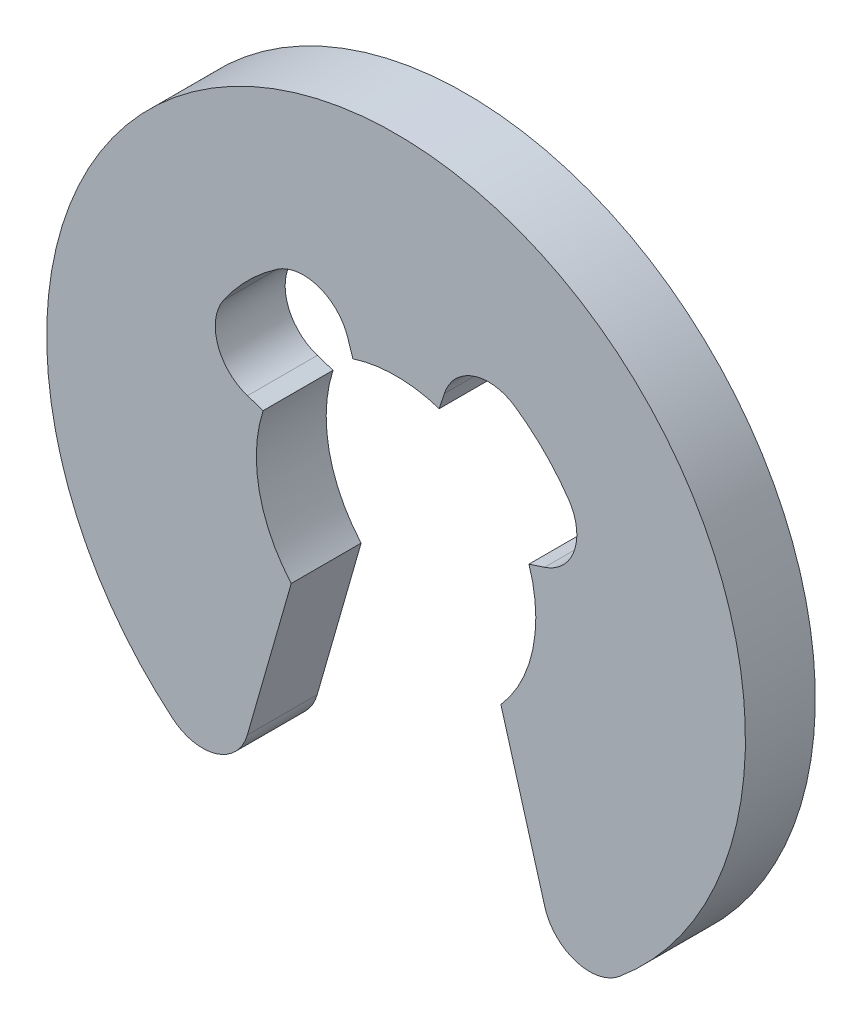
SolidWorks part; units mm, degrees
ref_plane "Front" through (0, 0, 0) normal (0, 0, 1) x (1, 0, 0)
ref_plane "Top" through (0, 0, 0) normal (0, 1, 0) x (1, 0, 0)
ref_plane "Right" through (0, 0, 0) normal (1, 0, 0) x (0, 0, -1)
sketch "Sketch1" plane through (0, 0, 0) normal (0, 0, 1) x (1, 0, 0)
  line L0 (0, 2.1875) -> (0, -1.9262) construction
  line L1 (-1.6904, 0) -> (1.9829, 0) construction
  line L2 (0, 0) -> (0.4635, 1.4266) construction
  line L3 (0, 0) -> (1.4266, 0.4635) construction
  line L4 (0.2073, 0.638) -> (0.1854, 0.5706)
  line L5 (0.5706, 0.1854) -> (0.638, 0.2073)
  line L6 (0.45, -0.3969) -> (0.6387, -1.0549)
  line L7 (-0.5706, 0.1854) -> (-0.638, 0.2073)
  line L8 (-0.2073, 0.638) -> (-0.1854, 0.5706)
  line L9 (-0.45, -0.3969) -> (-0.6387, -1.0549)
  arc A0 (0.9588, -1.1536) -> (-0.9588, -1.1536) centre (0, 0) ccw
  arc A1 (0.45, -0.3969) -> (0.5706, 0.1854) centre (0, 0) ccw
  arc A2 (0.7408, 0.5111) -> (0.5111, 0.7408) centre (0, 0) ccw
  arc A3 (0.7408, 0.5111) -> (0.638, 0.2073) centre (0.5762, 0.3975) cw
  arc A4 (0.6387, -1.0549) -> (0.9588, -1.1536) centre (0.8309, -0.9998) ccw
  arc A5 (-0.6387, -1.0549) -> (-0.9588, -1.1536) centre (-0.8309, -0.9998) cw
  arc A6 (0.1854, 0.5706) -> (-0.1854, 0.5706) centre (0, 0) ccw
  arc A7 (0.2073, 0.638) -> (0.5111, 0.7408) centre (0.3975, 0.5762) cw
  arc A8 (-0.45, -0.3969) -> (-0.5706, 0.1854) centre (0, 0) cw
  arc A9 (-0.7408, 0.5111) -> (-0.638, 0.2073) centre (-0.5762, 0.3975) ccw
  arc A10 (-0.2073, 0.638) -> (-0.5111, 0.7408) centre (-0.3975, 0.5762) ccw
  arc A11 (-0.7408, 0.5111) -> (-0.5111, 0.7408) centre (0, 0) cw
  point P17 (0.856, 0.2781)
  point P25 (0.2781, 0.856)
  dimension "D0" = 3
  dimension "d" = 1.2
  dimension "r2" = 0.2
  dimension "r1" = 0.2
  dimension "R" = 0.9
  dimension "D2" = 18
  dimension "D3" = 18
  dimension "D4" = 16
  dimension "B" = 0.9
extrude "Body" add sketch "Sketch1" against normal blind 0.3
equation "\"r2@Sketch1\" = \"r1@Sketch1\""
